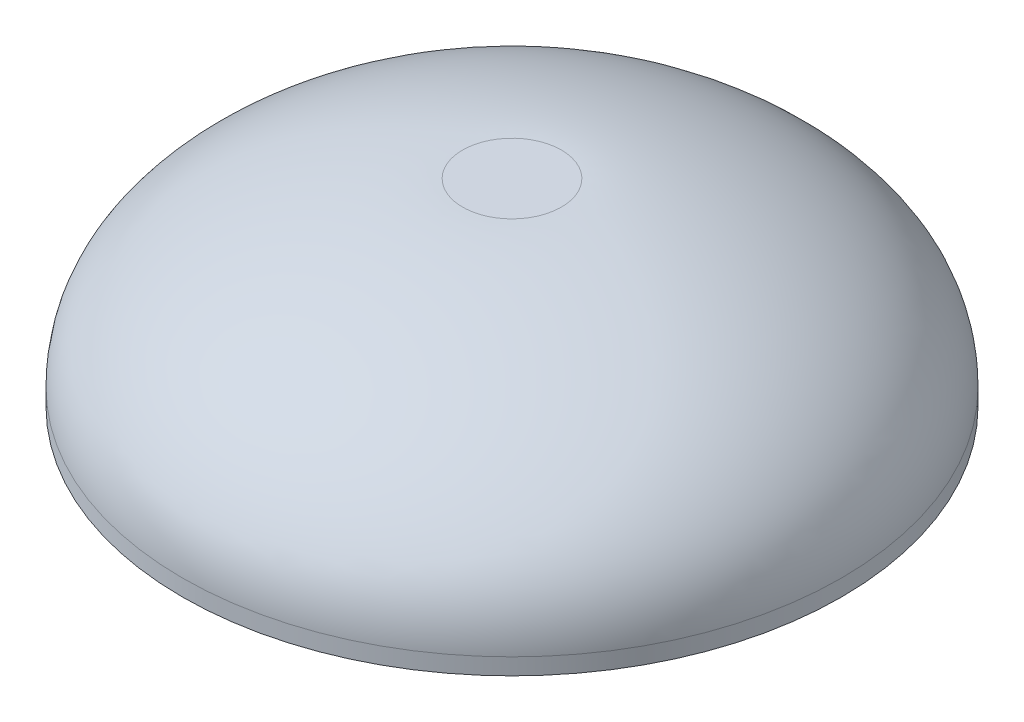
SolidWorks part; units mm, degrees
ref_plane "Front Plane" through (0, 0, 0) normal (0, 0, 1) x (1, 0, 0)
ref_plane "Top Plane" through (0, 0, 0) normal (0, 1, 0) x (1, 0, 0)
ref_plane "Right Plane" through (0, 0, 0) normal (1, 0, 0) x (0, 0, -1)
sketch "Sketch1" plane through (0, 0, 0) normal (0, 0, 1) x (1, 0, 0)
  line L0 (0, 0) -> (0, 152.4)
  line L1 (0, 0) -> (254, 0)
  line L2 (254, 0) -> (254, 12.7)
  line L4 (0, 152.4) -> (38.1, 152.4)
  spline S0 degree 3 poles (254, 12.7) (254, 37.4692) (214.4363, 116.005) (91.1821, 152.4) (38.1, 152.4) knots 0 0 0 0 0.232069 1 1 1 1
  dimension "D1" = 152.4
  dimension "D2" = 254
  dimension "D3" = 38.1
  dimension "D4" = 12.7
revolve "Revolve1" add sketch "Sketch1" angle 360 about L0
shell "Shell1" thickness 25.4
